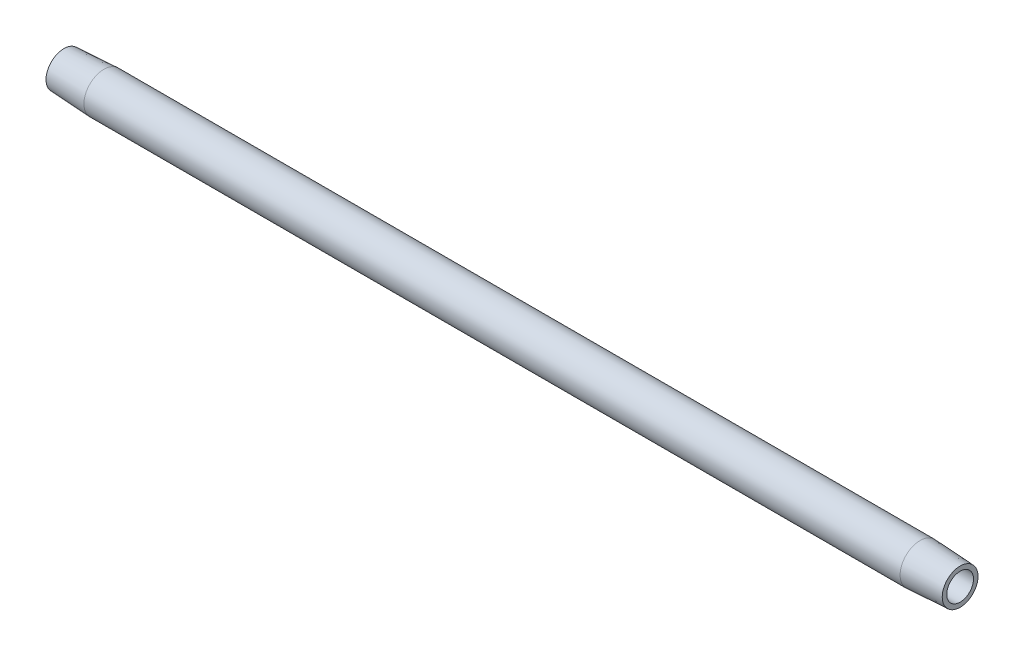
SolidWorks part; units mm, degrees
ref_plane "Front Plane" through (0, 0, 0) normal (0, 0, 1) x (1, 0, 0)
ref_plane "Top Plane" through (0, 0, 0) normal (0, 1, 0) x (1, 0, 0)
ref_plane "Right Plane" through (0, 0, 0) normal (1, 0, 0) x (0, 0, -1)
sketch "Sketch2" plane through (0, 0, 0) normal (0, 0, 1) x (1, 0, 0)
  line L0 (0.4761, 0) -> (50000.4761, 0) construction
  line L1 (0, -11.3625) -> (0, 49988.6375) construction
  line L7 (7.9375, 3.9687) -> (0, 3.5528)
  line L8 (169.8625, 3.9688) -> (7.9375, 3.9687)
  line L9 (177.8, 3.5528) -> (169.8625, 3.9688)
  line L10 (177.8, 2.6543) -> (177.8, 3.5528)
  line L11 (177.8, 2.6543) -> (0, 2.6543)
  line L12 (0, 3.5528) -> (0, 2.6543)
  dimension "D1" = 5.3086
  dimension "D2" = 7.9375
  dimension "D3" = 3
  dimension "D4" = 3
  dimension "D5" = 7.9375
  dimension "D6" = 7.9375
  dimension "D7" = 177.8
revolve "Revolve1" add sketch "Sketch2" angle 360 about L0
